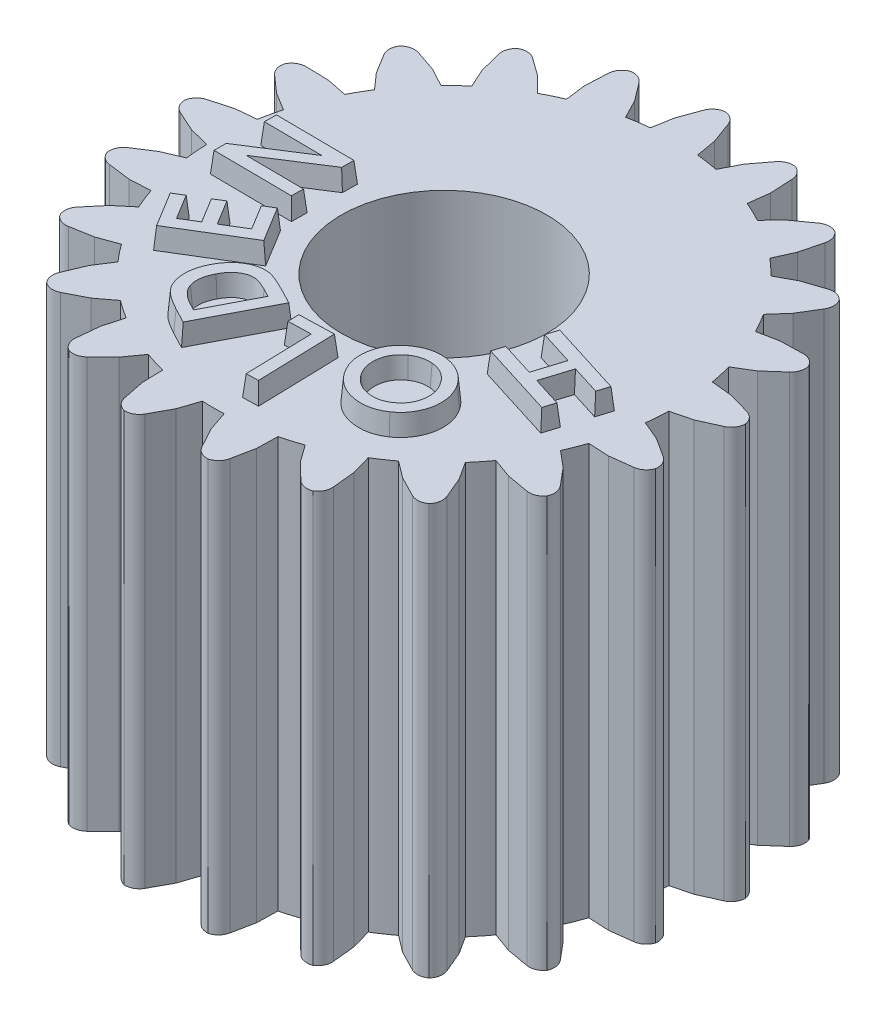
SolidWorks part; units mm, degrees
ref_plane "Front Plane" through (0, 0, 0) normal (0, 0, 1) x (1, 0, 0)
ref_plane "Top Plane" through (0, 0, 0) normal (0, 1, 0) x (1, 0, 0)
ref_plane "Right Plane" through (0, 0, 0) normal (1, 0, 0) x (0, 0, -1)
sketch "Sketch1" plane through (0, 0, 0) normal (0, 1, 0) x (1, 0, 0)
  circle A0 centre (0, 0) radius 28.575
  dimension "D1" = 57.15
extrude "Boss-Extrude1" add sketch "Sketch1" along normal blind 50.8
sketch "Sketch2" plane through (0, 50.8, 0) normal (0, 1, 0) x (1, 0, 0)
  line L0 (-2.921, 28.4253) -> (2.921, 28.4253)
  line L1 (2.921, 28.4253) -> (2.4731, 30.9653)
  line L2 (2.4731, 30.9653) -> (1.0864, 34.7753)
  line L3 (1.0864, 34.7753) -> (-1.0864, 34.7753)
  line L4 (-1.0864, 34.7753) -> (-2.4731, 30.9653)
  line L5 (-2.4731, 30.9653) -> (-2.921, 28.4253)
  circle A0 centre (0, 0) radius 28.575 construction
  dimension "D1" = 2.54
  dimension "D2" = 3.81
  dimension "D3" = 5.842
  dimension "D4" = 80
  dimension "D5" = 110
extrude "Boss-Extrude2" add sketch "Sketch2" against normal blind 50.8
fillet "Fillet1" radius 1.778 2 edges at (1.0864, 25.4, -34.7753) (-1.0864, 25.4, -34.7753)
pattern_circular "CirPattern1" count 21 over 360 about axis through (0, 0, 0) along (0, 1, 0) of "Fillet1", "Boss-Extrude2"
sketch "Sketch3" plane through (0, 50.8, 0) normal (0, 1, 0) x (1, 0, 0)
  circle A0 centre (0, 0) radius 12.7
  dimension "D1" = 25.4
extrude "Cut-Extrude1" cut sketch "Sketch3" against normal up to vertex
sketch "Sketch4" plane through (0, 50.8, 0) normal (0, 1, 0) x (1, 0, 0)
  circle A0 centre (0, 0) radius 15.875 construction
  circle A1 centre (0, 0) radius 12.7 construction
  arc A2 (-9.7016, -26.8777) -> (-7.1249, -27.6725) centre (0, 0) ccw construction
  text T0 "<b>HOLDEN</b>" font "Century Gothic" height 10.16
  dimension "D1" = 12.7
  dimension "D2" = 3.175
extrude "Boss-Extrude3" add sketch "Sketch4" along normal blind 2.54 draft 5
